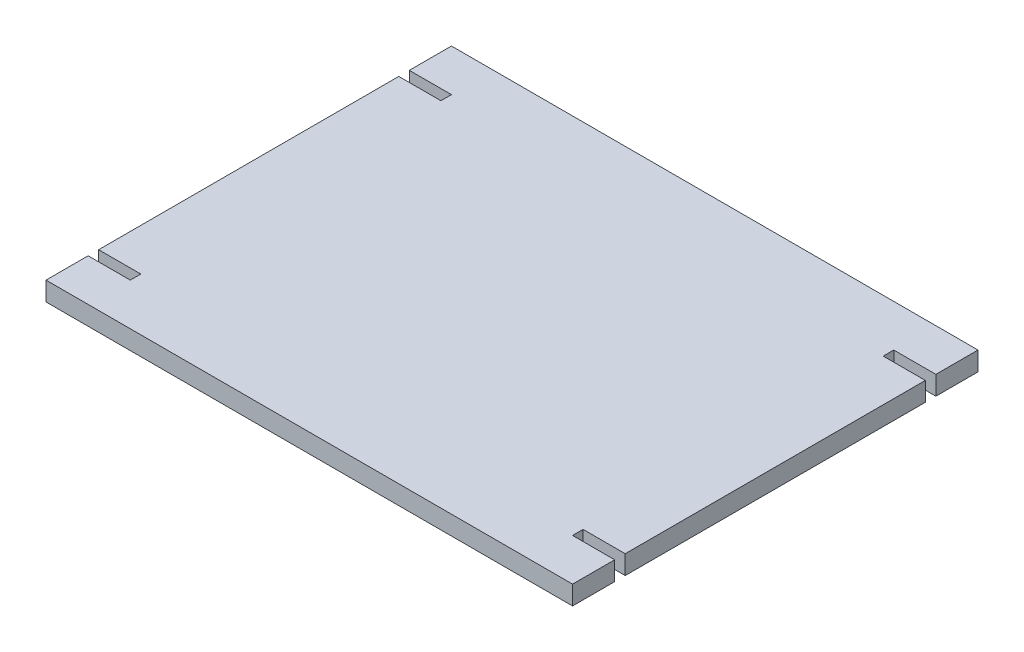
SolidWorks part; units mm, degrees
ref_plane "Front Plane" through (0, 0, 0) normal (0, 0, 1) x (1, 0, 0)
ref_plane "Top Plane" through (0, 0, 0) normal (0, 1, 0) x (1, 0, 0)
ref_plane "Right Plane" through (0, 0, 0) normal (1, 0, 0) x (0, 0, -1)
sketch "Sketch1" plane through (0, 0, 0) normal (0, 1, 0) x (1, 0, 0)
  line L0 (-301.875, 204.0625) -> (198.125, 204.0625)
  line L1 (198.125, 204.0625) -> (198.125, 164.0625)
  line L2 (198.125, 164.0625) -> (158.125, 164.0625)
  line L3 (158.125, 164.0625) -> (158.125, 154.0625)
  line L4 (158.125, 154.0625) -> (198.125, 154.0625)
  line L5 (198.125, 154.0625) -> (198.125, -130.9375)
  line L6 (198.125, -130.9375) -> (158.125, -130.9375)
  line L7 (158.125, -130.9375) -> (158.125, -140.9375)
  line L8 (158.125, -140.9375) -> (198.125, -140.9375)
  line L9 (198.125, -140.9375) -> (198.125, -180.9375)
  line L10 (198.125, -180.9375) -> (-301.875, -180.9375)
  line L11 (-301.875, -180.9375) -> (-301.875, -140.9375)
  line L12 (-301.875, -140.9375) -> (-261.875, -140.9375)
  line L13 (-261.875, -140.9375) -> (-261.875, -130.9375)
  line L14 (-261.875, -130.9375) -> (-301.875, -130.9375)
  line L15 (-301.875, -130.9375) -> (-301.875, 154.0625)
  line L16 (-301.875, 154.0625) -> (-261.875, 154.0625)
  line L17 (-261.875, 154.0625) -> (-261.875, 164.0625)
  line L18 (-261.875, 164.0625) -> (-301.875, 164.0625)
  line L19 (-301.875, 164.0625) -> (-301.875, 204.0625)
  dimension "D1" = 10
  dimension "D2" = 40
  dimension "D3" = 40
  dimension "D4" = 385
  dimension "D5" = 500
extrude "Boss-Extrude1" add sketch "Sketch1" along normal blind 18
